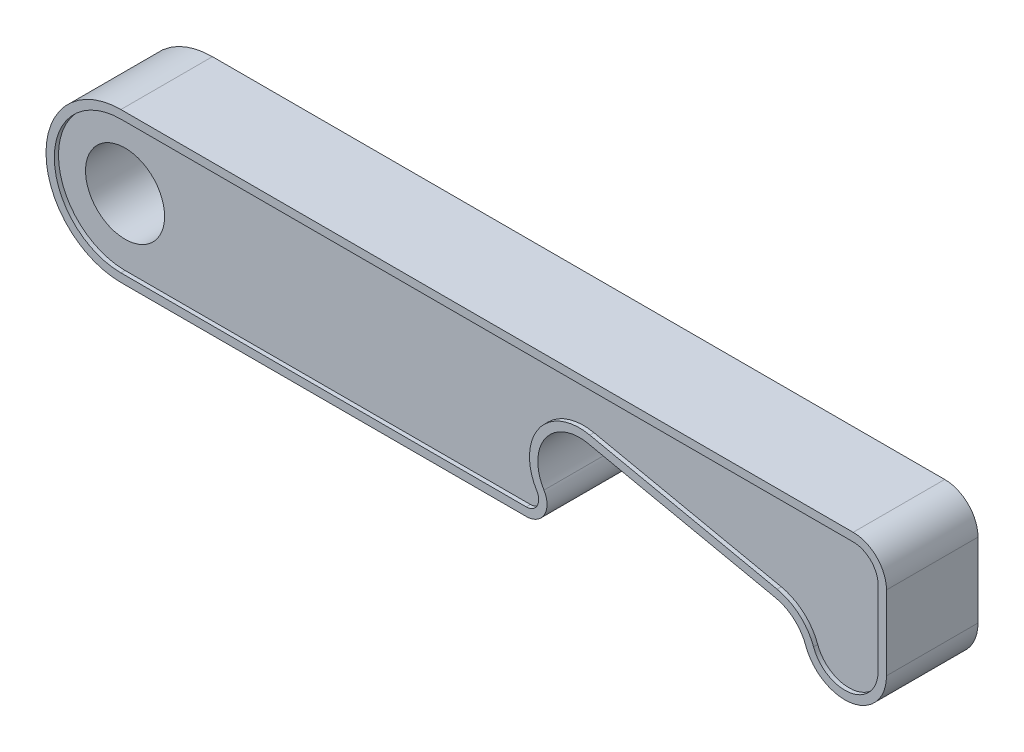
SolidWorks part; units mm, degrees
ref_plane "Front Plane" through (0, 0, 0) normal (0, 0, 1) x (1, 0, 0)
ref_plane "Top Plane" through (0, 0, 0) normal (0, 1, 0) x (1, 0, 0)
ref_plane "Right Plane" through (0, 0, 0) normal (1, 0, 0) x (0, 0, -1)
sketch "Sketch1"
other "AlignGroup1"
other "AlignGroup2"
other "AlignGroup3"
other "AlignGroup4"
extrude "Boss-Extrude1" add sketch "Sketch1" along normal mid plane 10
sketch "Sketch3" plane through (0, 0, 0) normal (0, 0, 1) x (1, 0, 0)
  line L0 (0, -8) -> (48.711, -8)
  line L1 (56.3505, 3.292) -> (78.8505, -1.4905)
  line L2 (91, -3.9392) -> (91, 5)
  line L3 (88, 8) -> (0, 8)
  line L4 (0, -9) -> (48.711, -9)
  line L5 (56.1426, 2.3139) -> (78.6426, -2.4686)
  line L6 (92, -3.9392) -> (92, 5)
  line L7 (88, 9) -> (0, 9)
  line L8 (0, -9) -> (48.711, -9)
  line L9 (56.1426, 2.3139) -> (78.6426, -2.4686)
  line L10 (92, -3.9392) -> (92, 5)
  line L11 (88, 9) -> (0, 9)
  arc A0 (48.711, -8) -> (49.9894, -5.7154) centre (48.711, -6.5) ccw
  arc A1 (56.3505, 3.292) -> (49.9894, -5.7154) centre (55.1031, -2.5769) ccw
  arc A2 (83.2412, -5.3073) -> (78.8505, -1.4905) centre (77.6031, -7.3594) ccw
  arc A3 (83.2412, -5.3073) -> (91, -3.9392) centre (87, -3.9392) ccw
  arc A4 (91, 5) -> (88, 8) centre (88, 5) ccw
  arc A5 (0, 8) -> (0, -8) centre (0, 0) ccw
  arc A6 (0, 9) -> (0, -9) centre (0, 0) ccw
  arc A7 (48.711, -9) -> (50.8417, -5.1923) centre (48.711, -6.5) ccw
  arc A8 (56.1426, 2.3139) -> (50.8417, -5.1923) centre (55.1031, -2.5769) ccw
  arc A9 (82.3015, -5.6493) -> (78.6426, -2.4686) centre (77.6031, -7.3594) ccw
  arc A10 (82.3015, -5.6493) -> (92, -3.9392) centre (87, -3.9392) ccw
  arc A11 (92, 5) -> (88, 9) centre (88, 5) ccw
  arc A12 (0, 9) -> (0, -9) centre (0, 0) ccw
  arc A13 (48.711, -9) -> (50.8417, -5.1923) centre (48.711, -6.5) ccw
  arc A14 (56.1426, 2.3139) -> (50.8417, -5.1923) centre (55.1031, -2.5769) ccw
  arc A15 (82.3015, -5.6493) -> (78.6426, -2.4686) centre (77.6031, -7.3594) ccw
  arc A16 (82.3015, -5.6493) -> (92, -3.9392) centre (87, -3.9392) ccw
  arc A17 (92, 5) -> (88, 9) centre (88, 5) ccw
  dimension "D1" = 0
  dimension "D2" = 1
extrude "Boss-Extrude2" add sketch "Sketch3" along normal mid plane 11
equation "\"A\"= 101"
equation "\"B\"=11"
equation "\"C\"= 1"
equation "\"D7@Sketch1\"=\"A\""
equation "\"D1@Boss-Extrude1\"=\"B\"-\"C\""
equation "\"D1@Boss-Extrude2\"=\"B\""
